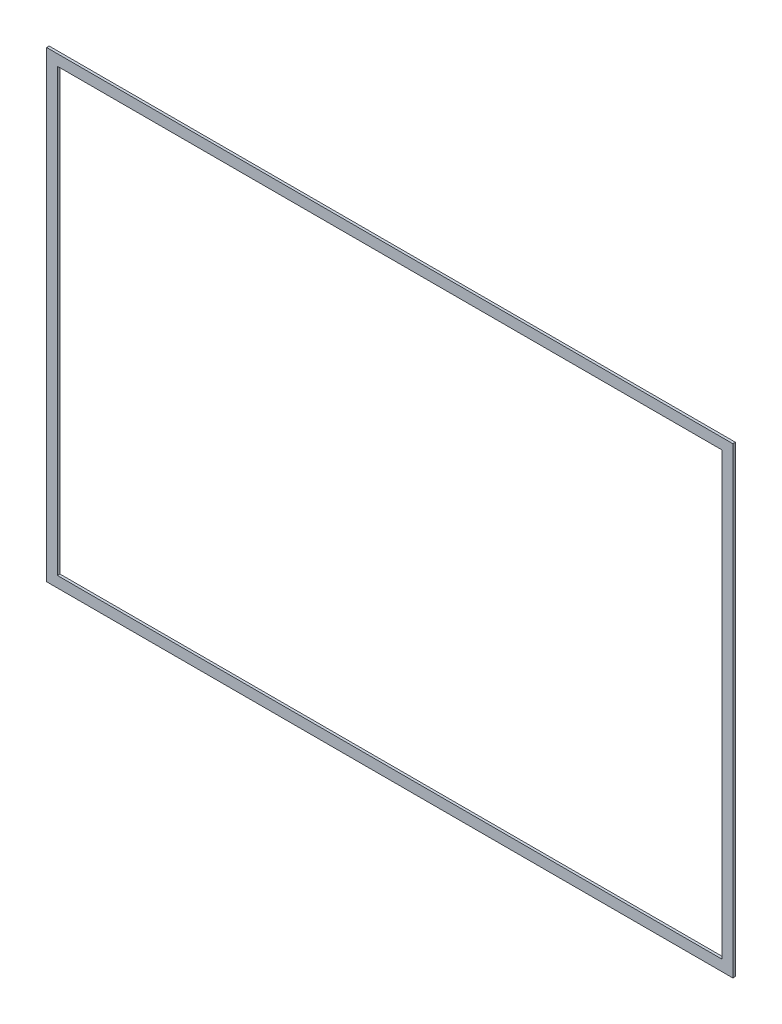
SolidWorks part; units mm, degrees
ref_plane "Alzado" through (0, 0, 0) normal (0, 0, 1) x (1, 0, 0)
ref_plane "Planta" through (0, 0, 0) normal (0, 1, 0) x (1, 0, 0)
ref_plane "Vista lateral" through (0, 0, 0) normal (1, 0, 0) x (0, 0, -1)
sketch "Croquis1" plane through (0, 0, 0) normal (0, 0, 1) x (1, 0, 0)
  line L1 (0, 0) -> (947, 0)
  line L2 (0, 0) -> (0, 638.5)
  line L3 (0, 638.5) -> (947, 638.5)
  line L4 (947, 0) -> (947, 638.5)
  line L5 (15, 15) -> (932, 15)
  line L6 (15, 15) -> (15, 623.5)
  line L7 (15, 623.5) -> (932, 623.5)
  line L8 (932, 15) -> (932, 623.5)
  dimension "D1" = 947
  dimension "D2" = 638.5
  dimension "D3" = 15
  dimension "D4" = 15
  dimension "D5" = 15
  dimension "D6" = 15
extrude "Saliente-Extruir1" add sketch "Croquis1" along normal blind 3.5
